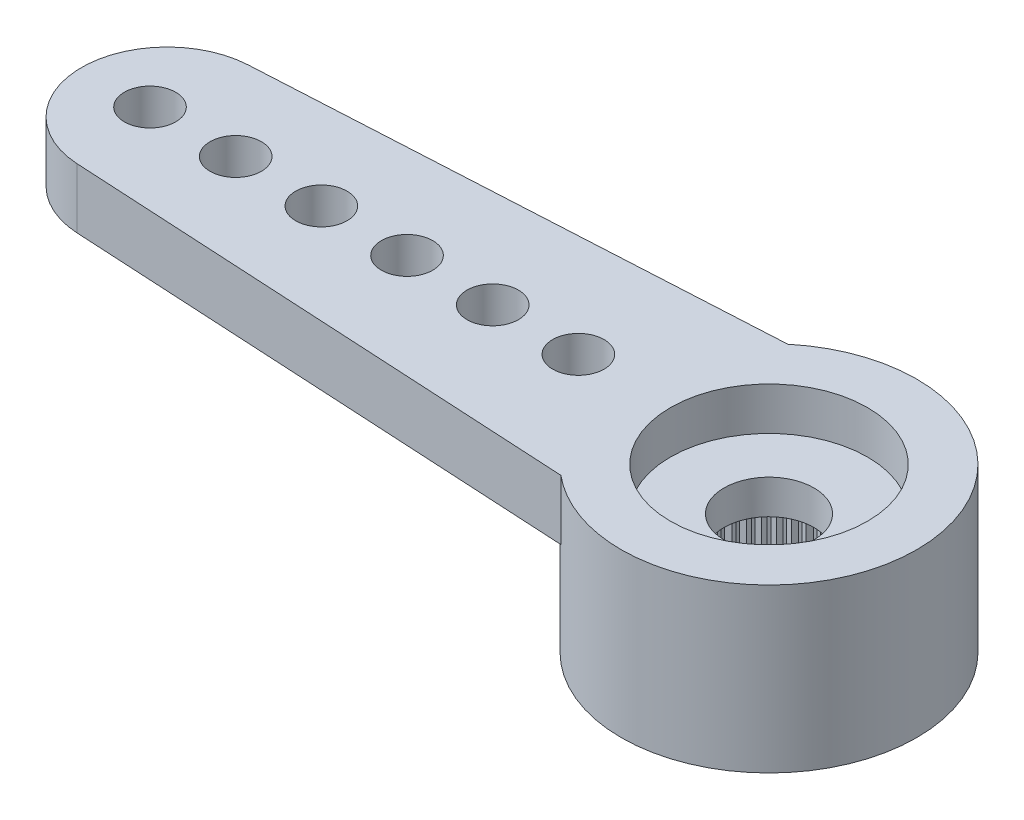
SolidWorks part; units mm, degrees
ref_plane "Plano frontal" through (0, 0, 0) normal (0, 0, 1) x (1, 0, 0)
ref_plane "Plano superior" through (0, 0, 0) normal (0, 1, 0) x (1, 0, 0)
ref_plane "Plano direito" through (0, 0, 0) normal (1, 0, 0) x (0, 0, -1)
sketch "Esboço1" plane through (0, 0, 0) normal (0, 1, 0) x (1, 0, 0)
  line L0 (0, 0) -> (-14.05, 0) construction
  line L1 (-14.1591, 1.997) -> (-2.2091, 2.65)
  line L2 (-2.2091, -2.65) -> (-14.1591, -1.997)
  arc A0 (-2.2091, -2.65) -> (-2.2091, 2.65) centre (0, 0) ccw
  arc A1 (-14.1591, 1.997) -> (-14.1591, -1.997) centre (-14.05, 0) ccw
  dimension "D1" = 6.9
  dimension "D2" = 4
  dimension "D3" = 19.5
  dimension "D4" = 5.3
extrude "Ressalto-extrusão1" add sketch "Esboço1" against normal blind 1.4
sketch "Esboço2" plane through (0, -1.4, 0) normal (0, -1, 0) x (1, 0, 0)
  arc A0 (-2.2091, -2.65) -> (-2.2091, 2.65) centre (0, 0) ccw construction
  circle A1 centre (0, 0) radius 3.45
extrude "Ressalto-extrusão2" add sketch "Esboço2" along normal offset from surface (2.4 mm away) 3.8
hole_wizard "Furo4" positions "Esboço9" profile "Esboço10" legacy
sketch "Esboço9" plane through (0, 0, 0) normal (0, 1, 0) x (1, 0, 0)
  line L1 (-14.45, 0) -> (0, 0) construction
  arc A2 (-14.1591, 1.997) -> (-14.1591, -1.997) centre (-14.05, 0) ccw construction
  point P0 (-14.45, 0)
  point P19 (-16.05, 0)
  dimension "D1" = 1.6
sketch "Esboço10" plane through (-14.45, 0, 0) normal (1, 0, 0) x (0, 0, 1)
  line L0 (0, 0) -> (0, 3.8)
  line L1 (0, 3.8) -> (0.6, 3.8)
  line L2 (0.6, 3.8) -> (0.6, 0)
  line L3 (0.6, 0) -> (0, 0)
  line L4 (0, 110) -> (0, -10) construction
  dimension "Diameter" = 1.2
  dimension "Depth" = 3.8
pattern_linear "Padrão linear1" count 6 spacing 2 along (1, 0, 0) of "Furo4"
hole_wizard "Furo1" positions "Esboço3" profile "Esboço4" legacy
sketch "Esboço3" plane through (0, -3.8, 0) normal (0, -1, 0) x (-1, 0, 0)
  point P0 (0, 0)
sketch "Esboço4" plane through (0, -3.8, 0) normal (1, 0, 0) x (0, 0, -1)
  line L0 (0, 0) -> (0, 2)
  line L1 (0, 2) -> (2.475, 2)
  line L2 (2.475, 2) -> (2.475, 0)
  line L3 (2.475, 0) -> (0, 0)
  line L4 (0, 110) -> (0, -10) construction
  dimension "Diameter" = 4.95
  dimension "Depth" = 2
hole_wizard "Furo2" positions "Esboço5" profile "Esboço6" legacy
sketch "Esboço5" plane through (0, 0, 0) normal (0, 1, 0) x (1, 0, 0)
  point P0 (0, 0)
sketch "Esboço6" plane through (0, 0, 0) normal (1, 0, 0) x (0, 0, 1)
  line L0 (0, 0) -> (0, 1)
  line L1 (0, 1) -> (2.3, 1)
  line L2 (2.3, 1) -> (2.3, 0)
  line L3 (2.3, 0) -> (0, 0)
  line L4 (0, 110) -> (0, -10) construction
  dimension "Diameter" = 4.6
  dimension "Depth" = 1
hole_wizard "Furo3" positions "Esboço7" profile "Esboço8" legacy
sketch "Esboço7" plane through (0, 0, 0) normal (0, 1, 0) x (1, 0, 0)
  point P0 (0, 0)
sketch "Esboço8" plane through (0, 0, 0) normal (1, 0, 0) x (0, 0, 1)
  line L0 (0, 0) -> (0, 3.8)
  line L1 (0, 3.8) -> (1.05, 3.8)
  line L2 (1.05, 3.8) -> (1.05, 0)
  line L3 (1.05, 0) -> (0, 0)
  line L4 (0, 110) -> (0, -10) construction
  dimension "Diameter" = 2.1
  dimension "Depth" = 3.8
sketch "Esboço11" plane through (0, -3.8, 0) normal (0, -1, 0) x (1, 0, 0)
  line L0 (-0.0981, 2.4731) -> (0, 2.375)
  line L1 (0, 2.375) -> (0.0981, 2.4731)
  line L2 (0, 0) -> (0, 2.475) construction
  circle A0 centre (0, 0) radius 2.375 construction
  circle A1 centre (0, 0) radius 2.475
  arc A2 (0.0981, 2.4731) -> (-0.0981, 2.4731) centre (0, 0) ccw
  dimension "D3" = 4.75
  dimension "D2" = 0.1
  dimension "D1" = 0
extrude "Ressalto-extrusão3" add sketch "Esboço11" against normal up to surface (2 mm away)
pattern_circular "PadrãoCircular1" count 60 over 360 about axis through (0, 0, 0) along (0, 1, 0) of "Ressalto-extrusão3"
sketch "Esquisse1" plane through (0, 0, 0) normal (0, 1, 0) x (1, 0, 0)
  line L0 (-14.1591, 1.997) -> (-2.2091, 2.65)
  line L1 (-2.2091, 2.65) -> (-14.1591, 1.997) construction
  line L3 (-2.2091, -2.65) -> (-14.1591, -1.997)
  arc A0 (-2.2091, -2.65) -> (-2.2091, 2.65) centre (0, 0) ccw
  arc A1 (-14.1591, 1.997) -> (-14.1591, -1.997) centre (-14.05, 0) ccw
  arc A2 (-14.1591, 1.997) -> (-14.1591, -1.997) centre (-14.05, 0) ccw construction
  point P16 (-16.05, 0)
